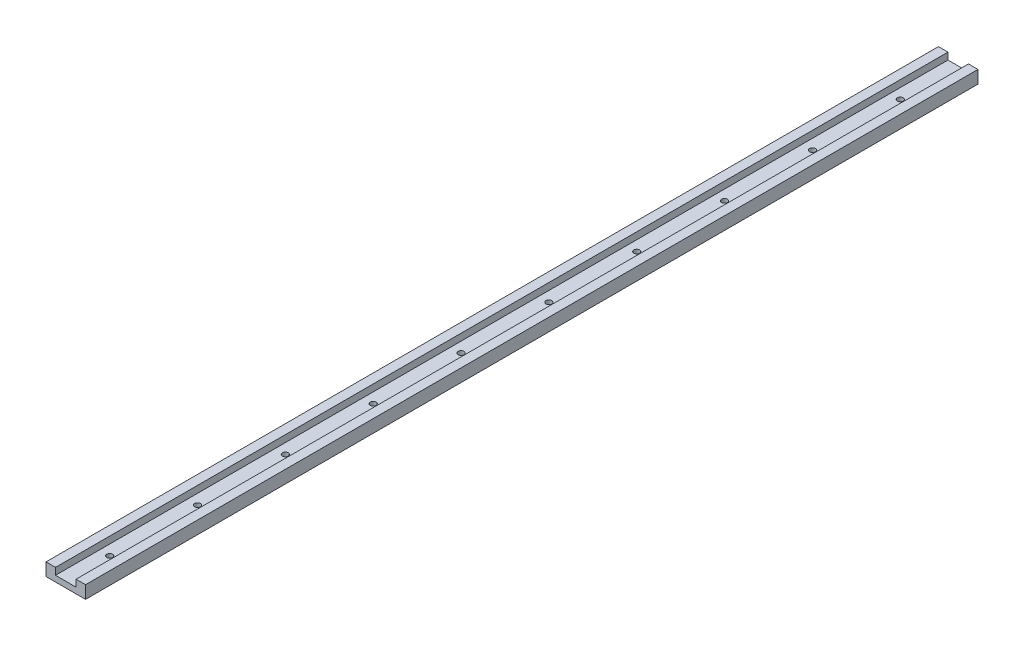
SolidWorks part; units mm, degrees
ref_plane "Front Plane" through (0, 0, 0) normal (0, 0, 1) x (1, 0, 0)
ref_plane "Top Plane" through (0, 0, 0) normal (0, 1, 0) x (1, 0, 0)
ref_plane "Right Plane" through (0, 0, 0) normal (1, 0, 0) x (0, 0, -1)
sketch "Sketch1" plane through (0, 0, 0) normal (0, 0, 1) x (1, 0, 0)
  line L0 (7, 4.35) -> (13.5, 4.35)
  line L1 (-13.5, -4.35) -> (13.5, -4.35)
  line L2 (-13.5, -4.35) -> (-13.5, 4.35)
  line L3 (-13.5, 4.35) -> (-7, 4.35)
  line L4 (13.5, -4.35) -> (13.5, 4.35)
  line L5 (-13.5, -4.35) -> (13.5, 4.35) construction
  line L6 (-13.5, 4.35) -> (13.5, -4.35) construction
  line L7 (0, -0.35) -> (0, -4.35) construction
  line L8 (-7, 4.35) -> (-7, -0.35)
  line L9 (-7, -0.35) -> (7, -0.35)
  line L10 (7, 4.35) -> (7, -0.35)
  point P0 (0, 0)
  dimension "D1" = 14
  dimension "D2" = 8.7
  dimension "D3" = 27
  dimension "D4" = 4
extrude "Boss-Extrude1" add sketch "Sketch1" along normal blind 609.6
sketch "Sketch2" plane through (0, -0.35, 0) normal (0, 1, 0) x (1, 0, 0)
  line L0 (0, -609.6) -> (0, -579.6) construction
  line L1 (7, -609.6) -> (-7, -609.6) construction
  circle A0 centre (0, -579.6) radius 2
  dimension "D1" = 4
  dimension "D2" = 30
extrude "Cut-Extrude1" cut sketch "Sketch2" against normal through all
pattern_linear "LPattern1" count 10 spacing 60 along (0, 0, -1) of "Cut-Extrude1"
